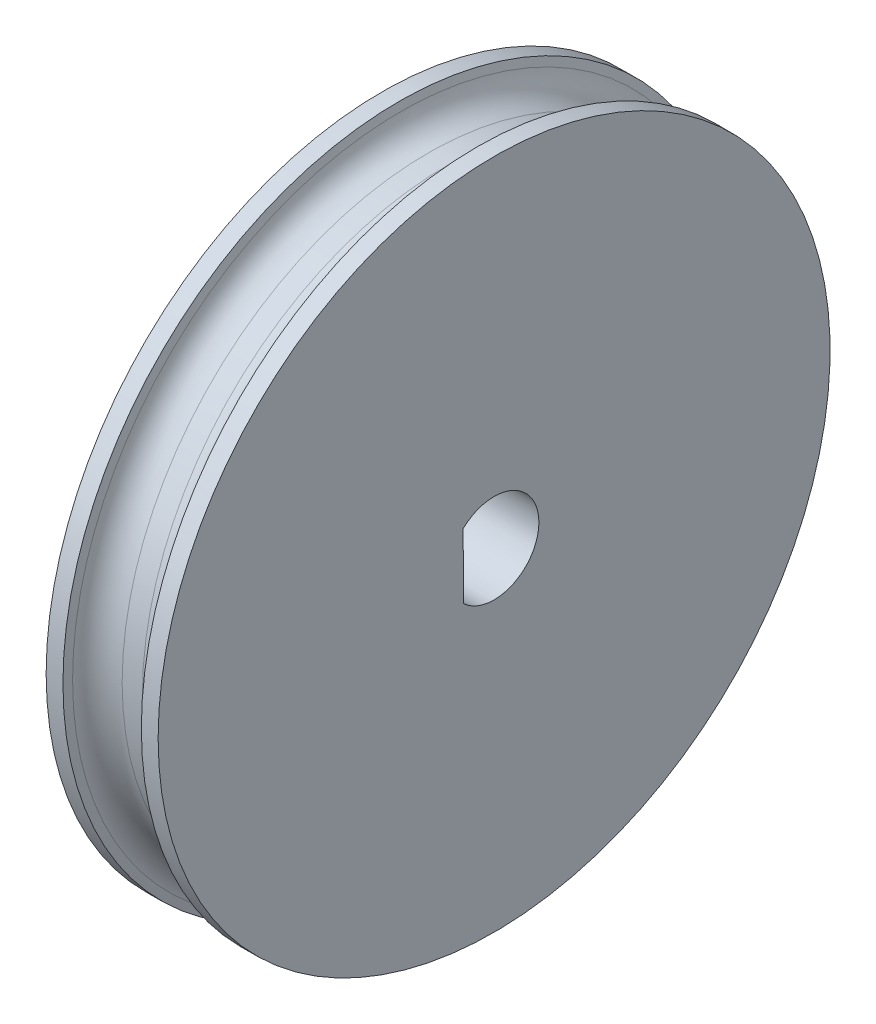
SolidWorks part; units mm, degrees
ref_plane "前视基准面" through (0, 0, 0) normal (0, 0, 1) x (1, 0, 0)
ref_plane "上视基准面" through (0, 0, 0) normal (0, 1, 0) x (1, 0, 0)
ref_plane "右视基准面" through (0, 0, 0) normal (1, 0, 0) x (0, 0, -1)
sketch "草图1" plane through (0, 0, 0) normal (0, 0, 1) x (1, 0, 0)
  line L0 (-22.6859, 0.1173) -> (22.9117, 0.1173) construction
  line L1 (0, 42.9253) -> (0, -42.3693) construction
  line L2 (-1.9999, 0.1173) -> (-1.9999, 12.1173)
  line L3 (-1.9999, 12.1173) -> (-1.3999, 12.1173)
  line L4 (-1.3999, 12.1173) -> (-1.1712, 11.0413)
  line L5 (-1.1712, 11.0413) -> (1.1714, 11.0413)
  line L6 (1.1714, 11.0413) -> (1.4001, 12.1173)
  line L7 (1.4001, 12.1173) -> (2.0001, 12.1173)
  line L8 (2.0001, 12.1173) -> (2.0001, 0.1173)
  line L9 (-1.9999, 0.1173) -> (2.0001, 0.1173)
  point P8 (0, 0)
  dimension "D1" = 4
  dimension "D2" = 102
  dimension "D3" = 102
  dimension "D4" = 0.6
  dimension "D5" = 12
  dimension "D6" = 12
  dimension "D7" = 0.6
revolve "旋转" add sketch "草图1" angle 360 about L0
fillet "圆角1" radius 1 2 edges at (-1.1712, 0.1173, 10.924) (1.1714, 0.1173, 10.924)
sketch "草图2" plane through (-1.9999, 0, 0) normal (-1, 0, 0) x (0, 0, 1)
  circle A0 centre (0, 0) radius 4.5
  dimension "D1" = 9
extrude "凸台-拉伸1" add sketch "草图2" along normal blind 0.5
sketch "草图3" plane through (-2.4999, 0, 0) normal (-1, 0, 0) x (0, 0, 1)
  line L0 (1.0952, -1.1665) -> (1.1048, 1.1573)
  arc A0 (1.1048, 1.1573) -> (1.0952, -1.1665) centre (0, 0) ccw
  point P10 (1.1, -0.0046)
  dimension "D1" = 3.2
  dimension "D2" = 1.1
fillet "圆角2" radius 0.5 1 edges at (-2.4999, 0, 4.5)
extrude "切除-拉伸1" cut sketch "草图3" against normal blind 10
